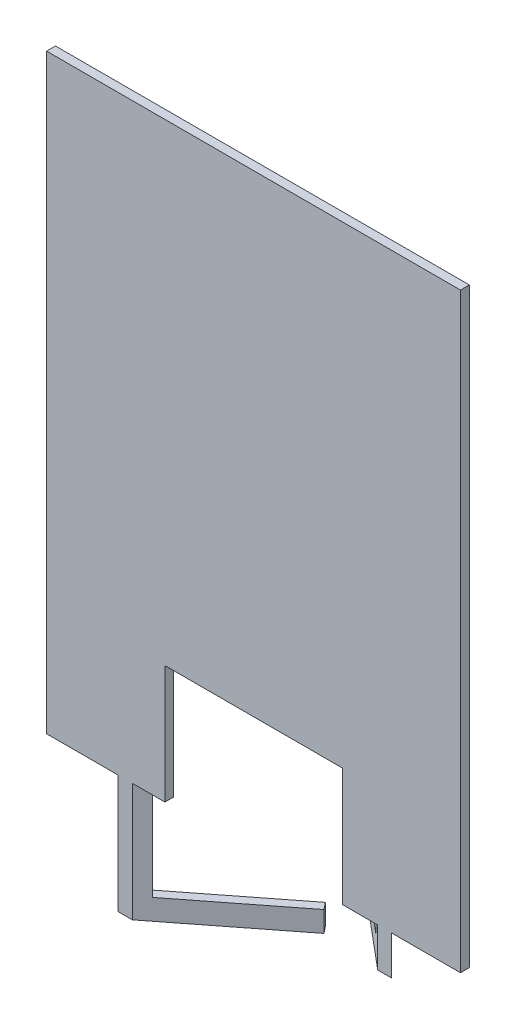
SolidWorks part; units mm, degrees
ref_plane "Front Plane" through (0, 0, 0) normal (0, 0, 1) x (1, 0, 0)
ref_plane "Top Plane" through (0, 0, 0) normal (0, 1, 0) x (1, 0, 0)
ref_plane "Right Plane" through (0, 0, 0) normal (1, 0, 0) x (0, 0, -1)
ref_plane "Plane1" through (0, -304.8, 0) normal (0, 1, 0) x (1, 0, 0)
sketch "Sketch1" plane through (0, 0, 0) normal (0, 0, 1) x (1, 0, 0)
  line L1 (88.9, -254) -> (-88.9, -254)
  line L2 (88.9, -254) -> (88.9, 0)
  line L3 (88.9, 0) -> (-88.9, 0)
  line L4 (-88.9, -254) -> (-88.9, 0)
  line L5 (88.9, -254) -> (-88.9, 0) construction
  line L6 (88.9, 0) -> (-88.9, -254) construction
  point P0 (0, -127)
  dimension "D1" = 254
  dimension "D2" = 177.8
extrude "Boss-Extrude1" add sketch "Sketch1" along normal blind 3.81
sketch "Sketch2" plane through (0, -304.8, 0) normal (0, -1, 0) x (1, 0, 0)
  line L0 (59.2673, 3.81) -> (14.515, -33.7417)
  line L1 (14.515, -33.7417) -> (12.066, -30.823)
  line L2 (12.066, -30.823) -> (53.34, 3.81)
  line L3 (53.34, 3.81) -> (59.2673, 3.81)
  line L6 (-88.9, 3.81) -> (88.9, 3.81) construction
  line L7 (0, 0) -> (0, -49.2825) construction
  dimension "D1" = 3.81
  dimension "D2" = 58.42
  dimension "D3" = 40
  dimension "D4" = 53.34
extrude "Boss-Extrude2" add sketch "Sketch2" against normal blind 157.48
sketch "Sketch3" plane through (0, -304.8, 0) normal (0, -1, 0) x (1, 0, 0)
  line L0 (-52.07, 3.81) -> (-58.2585, 3.81)
  line L1 (-88.9, 3.81) -> (53.34, 3.81) construction
  line L2 (-58.2585, 3.81) -> (-8.2198, -35.2845)
  line L3 (-8.2198, -35.2845) -> (-5.8741, -32.2822)
  line L4 (-5.8741, -32.2822) -> (-52.07, 3.81)
  line L6 (0, 0) -> (0, -45.9874) construction
  dimension "D1" = 3.81
  dimension "D2" = 63.5
  dimension "D3" = 38
  dimension "D4" = 52.07
extrude "Boss-Extrude3" add sketch "Sketch3" against normal blind 190.5
sketch "Sketch4" plane through (-88.9, 0, 0) normal (-1, 0, 0) x (0, 0, 1)
  line L0 (0, -114.3) -> (0, -254) construction
  line L1 (0, -123.19) -> (-35.2845, -123.19)
  line L2 (0, -123.19) -> (0, -295.91)
  line L3 (0, -295.91) -> (-35.2845, -295.91)
  line L4 (-35.2845, -123.19) -> (-35.2845, -295.91)
  line L5 (-35.2845, -114.3) -> (-35.2845, -304.8) construction
  line L6 (0, -114.3) -> (-35.2845, -114.3) construction
  line L7 (3.81, -304.8) -> (-35.2845, -304.8) construction
  dimension "D1" = 8.89
  dimension "D2" = 8.89
extrude "Cut-Extrude1" cut sketch "Sketch4" against normal up to vertex (83.0259 mm away)
ref_plane "Plane2" through (0, -118.745, 0) normal (0, 1, 0) x (1, 0, 0)
sketch "Sketch5" plane through (0, -118.745, 0) normal (0, 1, 0) x (1, 0, 0)
  line L0 (-5.8741, 32.2822) -> (-5.8741, 0)
  line L1 (88.9, 0) -> (-88.9, 0) construction
  line L2 (-5.8741, 0) -> (-47.1934, 0)
  line L3 (-47.1934, 0) -> (-5.8741, 32.2822)
extrude "Boss-Extrude4" add sketch "Sketch5" along normal mid plane 3.81
sketch "Sketch6" plane through (88.9, 0, 0) normal (1, 0, 0) x (0, 0, -1)
  line L0 (0, -254) -> (0, -147.32) construction
  line L1 (0, -156.21) -> (33.7417, -156.21)
  line L2 (0, -156.21) -> (0, -261.874)
  line L3 (0, -261.874) -> (33.7417, -261.874)
  line L4 (33.7417, -156.21) -> (33.7417, -261.874)
  line L5 (33.7417, -147.32) -> (33.7417, -304.8) construction
  line L6 (33.7417, -147.32) -> (0, -147.32) construction
  line L9 (17.8306, -270.764) -> (53.1781, -270.764) construction
  line L10 (-25.3966, -270.764) -> (33.7417, -270.764)
  line L11 (-25.3966, -270.764) -> (-25.3966, -339.0927)
  line L12 (-25.3966, -339.0927) -> (33.7417, -339.0927)
  line L13 (33.7417, -270.764) -> (33.7417, -339.0927)
  dimension "D1" = 8.89
  dimension "D2" = 8.89
extrude "Cut-Extrude2" cut sketch "Sketch6" against normal up to vertex (76.834 mm away)
sketch "Sketch7" plane through (0, 0, 0) normal (0, 0, -1) x (-1, 0, 0)
  line L0 (47.1934, -254) -> (-48.7994, -254) construction
  line L1 (-38.1, -254) -> (38.1, -254)
  line L2 (-38.1, -254) -> (-38.1, -203.2)
  line L3 (-38.1, -203.2) -> (38.1, -203.2)
  line L4 (38.1, -254) -> (38.1, -203.2)
  line L5 (0, 0) -> (0, -203.2) construction
  dimension "D1" = 50.8
  dimension "D2" = 76.2
extrude "Cut-Extrude3" cut sketch "Sketch7" against normal through all
